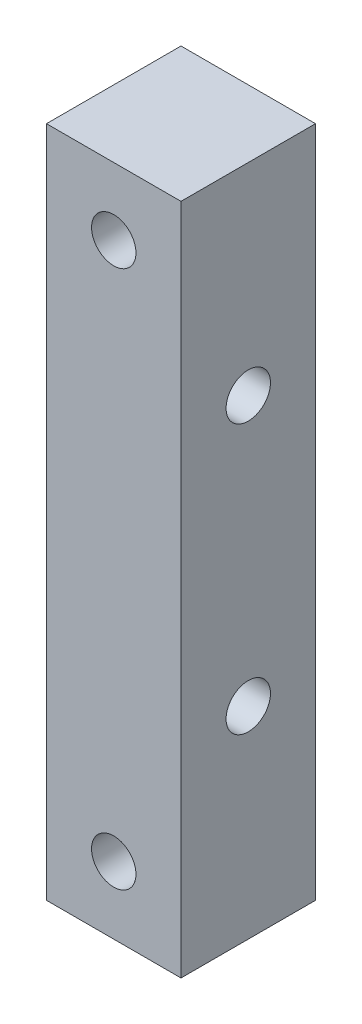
SolidWorks part; units mm, degrees
ref_plane "前视基准面" through (0, 0, 0) normal (0, 0, 1) x (1, 0, 0)
ref_plane "上视基准面" through (0, 0, 0) normal (0, 1, 0) x (1, 0, 0)
ref_plane "右视基准面" through (0, 0, 0) normal (1, 0, 0) x (0, 0, -1)
other "Configuration Table"
sketch "草图1" plane through (0, 0, 0) normal (0, 1, 0) x (1, 0, 0)
  line L1 (-5, 5) -> (5, 5)
  line L2 (-5, 5) -> (-5, -5)
  line L3 (-5, -5) -> (5, -5)
  line L4 (5, 5) -> (5, -5)
  line L5 (-5, 5) -> (5, -5) construction
  line L6 (-5, -5) -> (5, 5) construction
  point P0 (0, 0)
  dimension "D1" = 10
  dimension "D2" = 10
extrude "凸台-拉伸1" add sketch "草图1" along normal blind 50
hole_wizard "M4 螺纹孔1" positions "草图2" profile "草图3" tap size "M4" standard "GB"
sketch "草图2" plane through (0, 0, 5) normal (0, 0, 1) x (1, 0, 0)
  line L0 (-5, 50) -> (-5, 0) construction
  line L1 (-5, 0) -> (5, 0) construction
  line L2 (-5, 50) -> (5, 50) construction
  point P0 (0, 45)
  point P2 (0, 5)
  dimension "D1" = 5
  dimension "D2" = 5
  dimension "D3" = 5
  dimension "D4" = 5
sketch "草图3" plane through (0, 45, 5) normal (1, 0, 0) x (0, -1, 0)
  line L0 (0, 0) -> (0, 10)
  line L1 (0, 10) -> (1.65, 10)
  line L2 (1.65, 10) -> (1.65, 0)
  line L5 (1.65, 0) -> (0, 0)
  line L11 (0, -6.35) -> (0, 107.95) construction
  dimension "通孔螺纹孔钻头直径" = 3.3
  dimension "通孔螺纹孔钻头深度" = 10
hole_wizard "M4 螺纹孔2" positions "草图4" profile "草图5" tap size "M4" standard "GB"
sketch "草图4" plane through (5, 0, 0) normal (1, 0, 0) x (0, 0, -1)
  line L0 (-5, 50) -> (5, 50) construction
  point P0 (0, 35)
  point P2 (0, 15)
  dimension "D1" = 15
  dimension "D2" = 20
sketch "草图5" plane through (5, 35, 0) normal (0, 1, 0) x (0, 0, -1)
  line L0 (0, 0) -> (0, 10)
  line L1 (0, 10) -> (1.65, 10)
  line L2 (1.65, 10) -> (1.65, 0)
  line L5 (1.65, 0) -> (0, 0)
  line L11 (0, -6.35) -> (0, 107.95) construction
  dimension "通孔螺纹孔钻头直径" = 3.3
  dimension "通孔螺纹孔钻头深度" = 10
